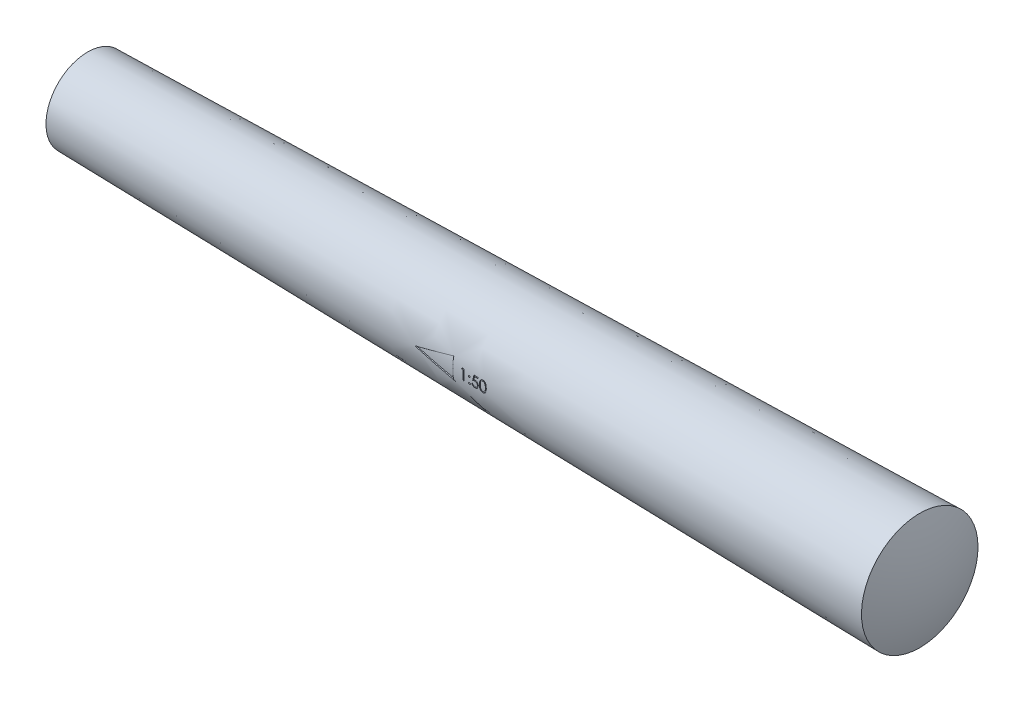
SolidWorks part; units mm, degrees
ref_plane "Front Plane" through (0, 0, 0) normal (0, 0, 1) x (1, 0, 0)
ref_plane "Top Plane" through (0, 0, 0) normal (0, 1, 0) x (1, 0, 0)
ref_plane "Right Plane" through (0, 0, 0) normal (1, 0, 0) x (0, 0, -1)
sketch "Sketch1" plane through (0, 0, 0) normal (1, 0, 0) x (0, 0, -1)
  circle A0 centre (0, 0) radius 4
  dimension "D1" = 8
extrude "Extrude1" add sketch "Sketch1" along normal mid plane 80
draft "Draft1" type of draft neutral plane draft angle 1.146 faces to draft 1 parameters "D1"=1.146
sketch "Sketch2" plane through (0, 0, 0) normal (0, 0, 1) x (1, 0, 0)
  line L0 (-40, 0) -> (-40, 4)
  line L1 (-40, 4) -> (-40, -4) construction
  line L2 (-40, 0) -> (-41, 0)
  line L3 (-41, 0) -> (-41, -4.8) construction
  line L4 (40, 0) -> (40, 5.6001)
  line L5 (40, -5.6001) -> (40, 5.6001) construction
  line L6 (40, 0) -> (41, 0)
  line L7 (41, 0) -> (41, -4.8) construction
  line L8 (-40, -4) -> (40, -5.6001) construction
  arc A0 (-41, 0) -> (-40, 4) centre (-32.5, 0) cw
  arc A1 (41, 0) -> (40, 5.6001) centre (24.8197, 0) ccw
  point P14 (0, -4.8)
revolve "Revolve1" add sketch "Sketch2" angle 360 about L2
sketch "Sketch5" plane through (0, 0, 0) normal (0, 0, 1) x (1, 0, 0)
  line L0 (0, 4.8) -> (0, -4.8) construction
  line L1 (40, 5.6001) -> (-40, 4) construction
  line L2 (-40, -4) -> (40, -5.6001) construction
ref_plane "Plane2" through (0, 0, 0) normal (-0.02, 0, 0.9998) x (0.9998, 0, 0.02)
sketch "Sketch6" plane through (0, 0, 0) normal (-0.02, 0, 0.9998) x (0.9998, 0, 0.02)
  line L0 (0, 0) -> (0, 1)
  line L1 (0, 4.8) -> (0, -4.8) construction
  line L2 (0, 1) -> (-3.7321, 0)
  line L3 (-3.7321, 0) -> (0, -1)
  line L4 (0, -1) -> (0, 0)
  line L5 (0, -0.5) -> (4, -0.5) construction
  text T0 "1:50" font "Century Gothic" height 1
  dimension "D1" = 2
  dimension "D2" = 30
  dimension "D3" = 4
wrap "Wrap2" sketch "Sketch6" wrap type deboss source sketch "Sketch6" thickness 0.1 parameters "D1"=0.1
equation "\"D2@Sketch2\" = \"D1@Sketch2\""
